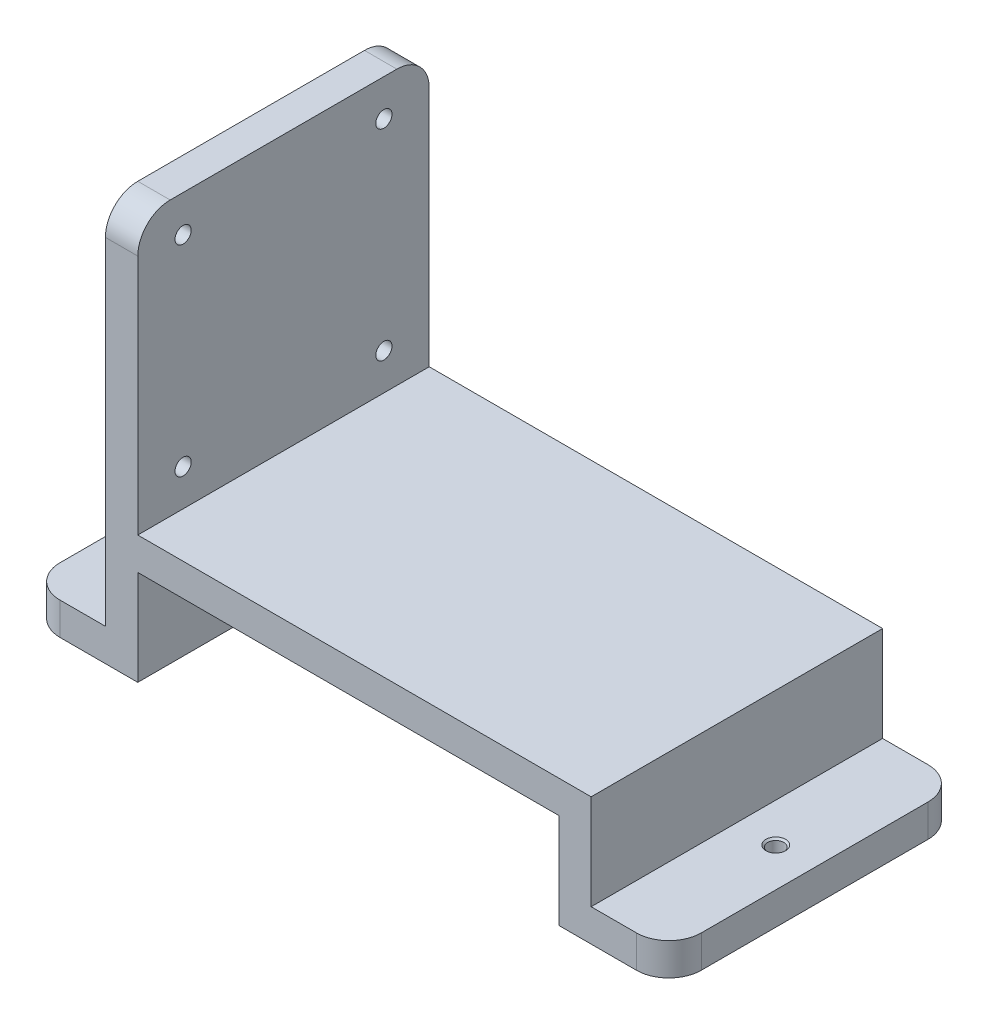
SolidWorks part; units mm, degrees
ref_plane "前视基准面" through (0, 0, 0) normal (0, 0, 1) x (1, 0, 0)
ref_plane "上视基准面" through (0, 0, 0) normal (0, 1, 0) x (1, 0, 0)
ref_plane "右视基准面" through (0, 0, 0) normal (1, 0, 0) x (0, 0, -1)
other "Configuration Table"
sketch "草图1" plane through (0, 0, 0) normal (0, 0, 1) x (1, 0, 0)
  line L0 (-32.5, 0) -> (32.5, 0)
  line L1 (-32.5, 0) -> (-32.5, -14.7)
  line L2 (-32.5, -14.7) -> (-49.5, -14.7)
  line L3 (-49.5, -14.7) -> (-49.5, -9.7)
  line L4 (-49.5, -9.7) -> (-37.5, -9.7)
  line L5 (-37.5, -9.7) -> (-37.5, 47.3)
  line L6 (-37.5, 47.3) -> (-32.5, 47.3)
  line L7 (-32.5, 47.3) -> (-32.5, 5)
  line L8 (-32.5, 5) -> (37.5, 5)
  line L9 (37.5, 5) -> (37.5, -9.7)
  line L10 (37.5, -9.7) -> (49.5, -9.7)
  line L11 (49.5, -9.7) -> (49.5, -14.7)
  line L12 (49.5, -14.7) -> (32.5, -14.7)
  line L13 (32.5, -14.7) -> (32.5, 0)
  point P4 (0, 0)
  point P15 (37.5, -2.35)
  point P18 (-32.5, 26.15)
  dimension "D1" = 70
  dimension "D2" = 5
  dimension "D3" = 5
  dimension "D4" = 5
  dimension "D5" = 5
  dimension "D6" = 5
  dimension "D7" = 12
  dimension "D8" = 12
  dimension "D9" = 62
  dimension "D10" = 42.3
  dimension "D11" = 40.85
extrude "凸台-拉伸1" add sketch "草图1" along normal blind 45
sketch "草图2" plane through (-32.5, 0, 0) normal (1, 0, 0) x (0, 0, -1)
  line L0 (-22.5, 50.4334) -> (-22.5, -0.7525) construction
  line L1 (-51.939, 26.15) -> (10.392, 26.15) construction
  line L6 (-45, 5) -> (0, 5) construction
  point P4 (-38, 41.65)
  point P5 (-38, 10.65)
  point P8 (-7, 10.65)
  point P9 (-7, 41.65)
  dimension "D1" = 31
  dimension "D2" = 31
  dimension "D3" = 5.65
sketch "草图5" plane through (0, -9.7, 0) normal (0, 1, 0) x (1, 0, 0)
  point P0 (43.5, -22.5)
  point P1 (-43.5, -22.5)
hole_wizard "M3 螺纹孔2" positions "草图5" profile "草图6" tap size "M3" standard "GB"
sketch "草图6" plane through (43.5, -9.7, 22.5) normal (1, 0, 0) x (0, 0, 1)
  line L0 (0, 0) -> (0, 8.2511)
  line L1 (0, 8.2511) -> (1.25, 7.5)
  line L2 (1.25, 7.5) -> (1.25, 0.275)
  line L3 (1.25, 0.275) -> (1.525, 0)
  line L5 (1.525, 0) -> (0, 0)
  line L6 (-1.25, 0.275) -> (-1.525, 0) construction
  line L10 (0, 8.2511) -> (-1.25, 7.5) construction
  line L11 (0, -6.35) -> (0, 107.95) construction
  dimension "螺纹孔钻头直径" = 2.5
  dimension "螺纹孔钻头深度" = 7.5
  dimension "近端锥形沉头孔直径" = 3.05
  dimension "近端锥形沉头孔角度" = 90
  dimension "导头角度" = 118
fillet "圆角1" radius 5 6 edges at (49.5, -12.2, 0) (49.5, -12.2, 45) (-35, 47.3, 0) (-35, 47.3, 45) (-49.5, -12.2, 0) (-49.5, -12.2, 45)
sketch "草图9" plane through (-37.5, 0, 0) normal (-1, 0, 0) x (0, 0, 1)
  point P0 (7, 41.65)
  point P1 (7, 10.65)
  point P3 (38, 10.65)
  point P5 (38, 41.65)
hole_wizard "M3 螺纹孔4" positions "草图9" profile "草图10" tap size "M3" standard "GB"
sketch "草图10" plane through (-37.5, 41.65, 7) normal (0, 1, 0) x (0, 0, 1)
  line L0 (0, 0) -> (0, 8.2511)
  line L1 (0, 8.2511) -> (1.25, 7.5)
  line L2 (1.25, 7.5) -> (1.25, 0.275)
  line L3 (1.25, 0.275) -> (1.525, 0)
  line L5 (1.525, 0) -> (0, 0)
  line L6 (-1.25, 0.275) -> (-1.525, 0) construction
  line L10 (0, 8.2511) -> (-1.25, 7.5) construction
  line L11 (0, -6.35) -> (0, 107.95) construction
  dimension "螺纹孔钻头直径" = 2.5
  dimension "螺纹孔钻头深度" = 7.5
  dimension "近端锥形沉头孔直径" = 3.05
  dimension "近端锥形沉头孔角度" = 90
  dimension "导头角度" = 118
